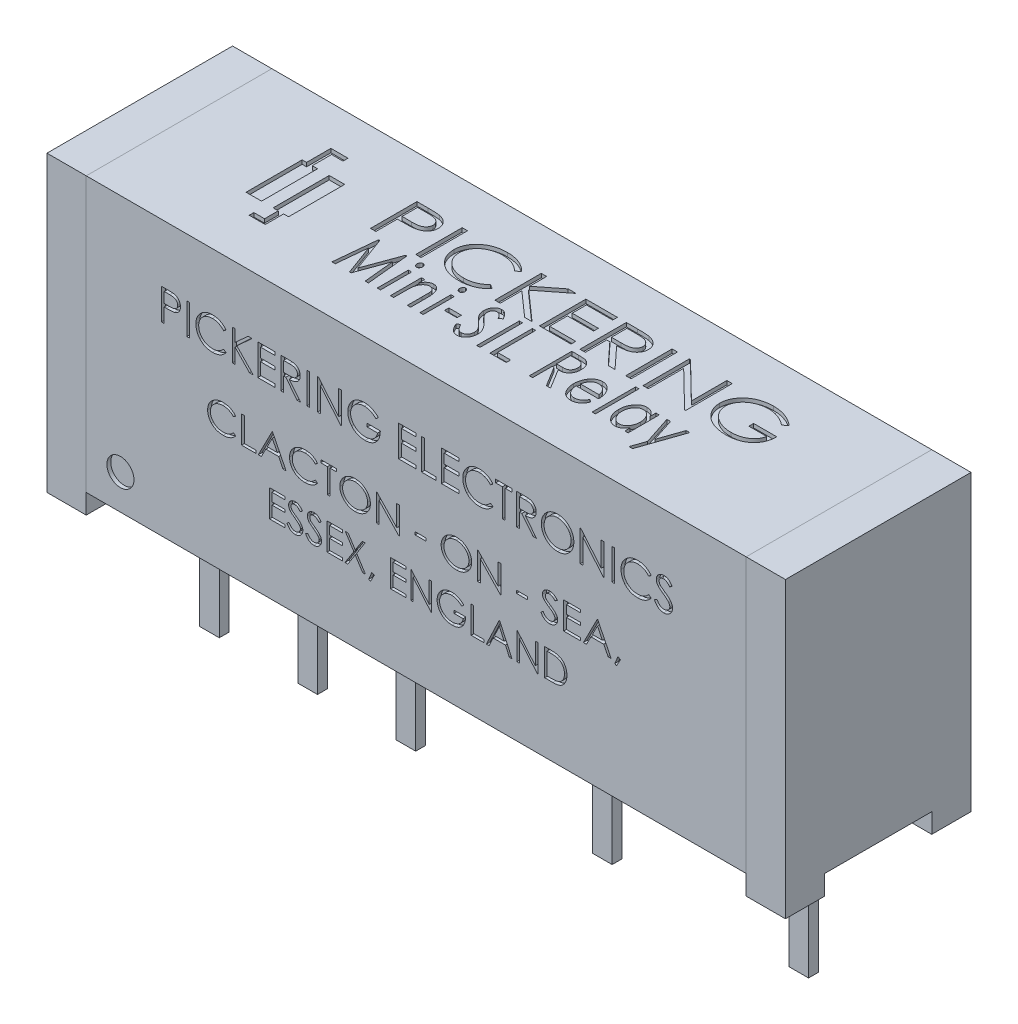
SolidWorks part; units mm, degrees
ref_plane "Front Plane" through (0, 0, 0) normal (0, 0, 1) x (1, 0, 0)
ref_plane "Top Plane" through (0, 0, 0) normal (0, 1, 0) x (1, 0, 0)
ref_plane "Right Plane" through (0, 0, 0) normal (1, 0, 0) x (0, 0, -1)
sketch "Sketch1" plane through (0, 0, 0) normal (0, 1, 0) x (1, 0, 0)
  line L1 (8.534, -2.4) -> (-8.534, -2.4)
  line L2 (8.534, -2.4) -> (8.534, 2.4)
  line L3 (8.534, 2.4) -> (-8.534, 2.4)
  line L4 (-8.534, -2.4) -> (-8.534, 2.4)
  line L5 (8.534, -2.4) -> (-8.534, 2.4) construction
  line L6 (8.534, 2.4) -> (-8.534, -2.4) construction
  point P0 (0, 0)
  dimension "D1" = 4.8
  dimension "D2" = 17.068
extrude "main box" add sketch "Sketch1" along normal blind 7.092
sketch "Sketch2" plane through (-8.534, 0, 0) normal (-1, 0, 0) x (0, 0, 1)
  line L0 (-2.4, 7.092) -> (2.4, 7.092)
  line L1 (2.4, 7.092) -> (2.4, -0.508)
  line L2 (2.4, -0.508) -> (-2.4, -0.508)
  line L3 (-2.4, -0.508) -> (-2.4, 7.092)
  dimension "D1" = 7.6
extrude "end section plus feet" add sketch "Sketch2" along normal blind 1.016 separate body
sketch "Sketch4" plane through (0, 0, 0) normal (0, -1, 0) x (1, 0, 0)
  line L1 (-7.874, -0.127) -> (-7.366, -0.127)
  line L2 (-7.874, -0.127) -> (-7.874, 0.127)
  line L3 (-7.874, 0.127) -> (-7.366, 0.127)
  line L4 (-7.366, -0.127) -> (-7.366, 0.127)
  line L5 (-7.874, -0.127) -> (-7.366, 0.127) construction
  line L6 (-7.874, 0.127) -> (-7.366, -0.127) construction
  line L7 (-5.334, -0.127) -> (-4.826, -0.127)
  line L8 (-5.334, -0.127) -> (-5.334, 0.127)
  line L9 (-5.334, 0.127) -> (-4.826, 0.127)
  line L10 (-4.826, -0.127) -> (-4.826, 0.127)
  line L11 (-5.334, -0.127) -> (-4.826, 0.127) construction
  line L12 (-5.334, 0.127) -> (-4.826, -0.127) construction
  line L13 (-2.286, -0.127) -> (-2.794, -0.127)
  line L14 (-2.286, -0.127) -> (-2.286, 0.127)
  line L15 (-2.286, 0.127) -> (-2.794, 0.127)
  line L16 (-2.794, -0.127) -> (-2.794, 0.127)
  line L17 (-2.286, -0.127) -> (-2.794, 0.127) construction
  line L18 (-2.286, 0.127) -> (-2.794, -0.127) construction
  line L19 (-9.55, 2.4) -> (-9.55, -2.4) construction
  line L20 (2.794, -0.127) -> (2.286, -0.127)
  line L21 (2.794, -0.127) -> (2.794, 0.127)
  line L22 (2.794, 0.127) -> (2.286, 0.127)
  line L23 (2.286, -0.127) -> (2.286, 0.127)
  line L24 (2.794, -0.127) -> (2.286, 0.127) construction
  line L25 (2.794, 0.127) -> (2.286, -0.127) construction
  line L26 (7.874, -0.127) -> (7.366, -0.127)
  line L27 (7.874, -0.127) -> (7.874, 0.127)
  line L28 (7.874, 0.127) -> (7.366, 0.127)
  line L29 (7.366, -0.127) -> (7.366, 0.127)
  line L30 (7.874, -0.127) -> (7.366, 0.127) construction
  line L31 (7.874, 0.127) -> (7.366, -0.127) construction
  point P0 (-7.62, 0)
  point P5 (-5.08, 0)
  point P11 (-2.54, 0)
  point P18 (2.54, 0)
  point P23 (7.62, 0)
  dimension "D1" = 0.254
  dimension "D2" = 0.508
  dimension "D3" = 0.254
  dimension "D4" = 0.508
  dimension "D5" = 0.254
  dimension "D6" = 0.508
  dimension "D7" = 1.93
  dimension "D8" = 2.54
  dimension "D9" = 2.54
  dimension "D10" = 5.08
  dimension "D11" = 0.254
  dimension "D12" = 0.508
  dimension "D13" = 0.254
  dimension "D14" = 0.508
  dimension "D15" = 5.08
extrude "Pins" add sketch "Sketch4" along normal blind 3.808
sketch "Sketch6"
  dimension "D1" = 10.15
  dimension "D2" = 9.25
  dimension "D3" = 5.7
  dimension "D4" = 6.05
  dimension "D5" = 2.3
  dimension "D6" = 1.25
extrude "Top writing" cut sketch "Sketch6" against normal blind 0.1
sketch "Sketch7"
  dimension "D1" = 14
  dimension "D2" = 2.55
  dimension "D3" = 2.3
extrude "Pickering electronics" cut sketch "Sketch7" against normal blind 0.1
sketch "Sketch8"
  dimension "D3" = 0.7
  dimension "D4" = 0.9
  dimension "D1" = 11
  dimension "D2" = 4
  dimension "D5" = 1.9
extrude "Address" cut sketch "Sketch8" against normal blind 0.1
sketch "Sketch9" plane through (0, 7.092, 0) normal (0, 1, 0) x (1, 0, 0)
  line L0 (8.534, 2.4) -> (-8.534, 2.4) construction
  line L1 (-5.4, 0.75) -> (-5, 0.75)
  line L2 (-5.4, 0.75) -> (-5.4, -0.7)
  line L3 (-5.4, -0.7) -> (-5.2668, -0.7)
  line L4 (-5, 0.75) -> (-5, -0.7)
  line L5 (-9.55, -2.4) -> (-9.55, 2.4) construction
  line L6 (-5.7, 0.75) -> (-5.8385, 0.75)
  line L7 (-5.7, 0.75) -> (-5.7, -0.7)
  line L8 (-5.7, -0.7) -> (-6.1, -0.7)
  line L9 (-6.1, 0.75) -> (-6.1, -0.7)
  line L10 (-5.9858, 0.75) -> (-6.1, 0.75)
  line L11 (-5.1282, -0.7) -> (-5, -0.7)
  line L12 (-5.9858, 0.75) -> (-5.9858, 1.3793)
  line L13 (-5.9858, 1.3793) -> (-5.8385, 1.3793)
  line L14 (-5.8385, 0.75) -> (-5.8385, 1.2494)
  line L15 (-5.8385, 1.3793) -> (-5.544, 1.3793)
  line L17 (-5.8385, 1.2494) -> (-5.544, 1.2494)
  line L18 (-5.544, 1.3793) -> (-5.544, 1.2494)
  line L20 (-5.1282, -0.7) -> (-5.1282, -1.176)
  line L21 (-5.1282, -1.176) -> (-5.2668, -1.176)
  line L22 (-5.2668, -0.7) -> (-5.2668, -1.0548)
  line L23 (-5.2668, -1.176) -> (-5.544, -1.176)
  line L25 (-5.2668, -1.0548) -> (-5.544, -1.0548)
  line L26 (-5.544, -1.176) -> (-5.544, -1.0548)
  dimension "D1" = 1.65
  dimension "D2" = 1.45
  dimension "D3" = 0.4
  dimension "D4" = 0.4
  dimension "D5" = 0.3
  dimension "D6" = 3.45
extrude "Pickering logo" cut sketch "Sketch9" against normal blind 0.1
sketch "Sketch10"
  dimension "D1" = 3.4
  dimension "D2" = 4
  dimension "D3" = 11.5
extrude "relay type" add sketch "Sketch10" along normal blind 0.0001
sketch "Sketch11" plane through (8.534, 0, 0) normal (1, 0, 0) x (0, 0, -1)
  line L1 (-2.4, 7.092) -> (2.4, 7.092)
  line L2 (-2.4, 7.092) -> (-2.4, -0.508)
  line L3 (-2.4, -0.508) -> (2.4, -0.508)
  line L4 (2.4, 7.092) -> (2.4, -0.508)
extrude "Extrude8" add sketch "Sketch11" along normal blind 1.016 separate body
sketch "Sketch12" plane through (-9.55, 0, 0) normal (-1, 0, 0) x (0, 0, 1)
  line L0 (-2.4, -0.508) -> (2.4, -0.508) construction
  line L1 (-1.384, -0.508) -> (1.384, -0.508)
  line L2 (-1.384, -0.508) -> (-1.384, 0)
  line L3 (-1.384, 0) -> (1.384, 0)
  line L4 (1.384, -0.508) -> (1.384, 0)
  line L5 (2.4, -0.508) -> (2.4, 7.092) construction
  dimension "D1" = 0.508
  dimension "D2" = 2.768
  dimension "D3" = 1.016
extrude "feet cut" cut sketch "Sketch12" against normal blind 1.016
sketch "Sketch13" plane through (9.55, 0, 0) normal (1, 0, 0) x (0, 0, -1)
  line L0 (-2.4, -0.508) -> (2.4, -0.508) construction
  line L1 (-1.384, -0.508) -> (1.384, -0.508)
  line L2 (-1.384, -0.508) -> (-1.384, 0)
  line L3 (-1.384, 0) -> (1.384, 0)
  line L4 (1.384, -0.508) -> (1.384, 0)
  line L6 (2.4, -0.508) -> (2.4, 7.092) construction
  dimension "D1" = 0.508
  dimension "D2" = 2.768
  dimension "D3" = 1.016
extrude "feet cut 2" cut sketch "Sketch13" against normal blind 1.016
